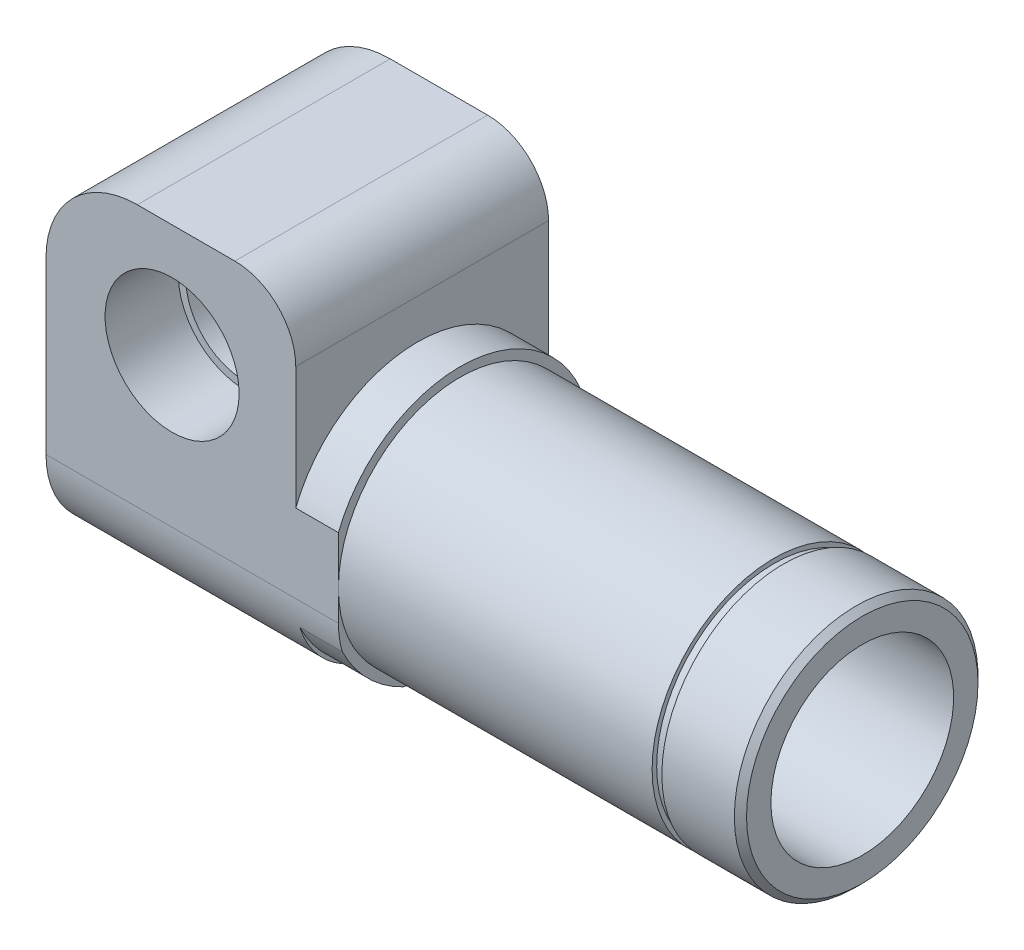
SolidWorks part; units mm, degrees
ref_plane "Face" through (0, 0, 0) normal (0, 0, 1) x (1, 0, 0)
ref_plane "Dessus" through (0, 0, 0) normal (0, 1, 0) x (1, 0, 0)
ref_plane "Droite" through (0, 0, 0) normal (1, 0, 0) x (0, 0, -1)
sketch "Esquisse1" plane through (0, 0, 0) normal (0, 0, 1) x (1, 0, 0)
  line L0 (0, 0) -> (54.7909, 0) construction
  line L1 (0, 5) -> (0, 20)
  line L2 (0, 20) -> (68, 20)
  line L5 (0, 5) -> (3, 5)
  line L6 (3, 5) -> (3, 15)
  line L7 (3, 15) -> (68, 15)
  line L10 (68, 20) -> (68, 15)
  dimension "D1" = 30
  dimension "D2" = 10
  dimension "D3" = 3
  dimension "D4" = 40
  dimension "D5" = 68
revolve "Révolution1" add sketch "Esquisse1" angle 360 about L0
hole_wizard "Fraisage pour vis à tête fraisée M31" positions "Esquisse3" profile "Esquisse2" countersink size "M3" standard "DIN"
sketch "Esquisse3" plane through (0, 0, 0) normal (-1, 0, 0) x (0, 0, 1)
  line L0 (0, 0) -> (7.3612, 4.25) construction
  line L1 (11.1801, -6.4548) -> (-13.0092, 7.5109) construction
  line L2 (0, -16.341) -> (0, 13.6222) construction
  circle A0 centre (0, 0) radius 8.5 construction
  point P0 (7.3612, 4.25)
  point P5 (0, -8.5)
  point P6 (-7.3612, 4.25)
  point P7 (0, -8.5)
  dimension "D1" = 17
  dimension "D2" = 60
  dimension "D3" = 60
sketch "Esquisse2" plane through (0, 4.25, 7.3612) normal (0, 1, 0) x (0, 0, 1)
  line L0 (0, 0) -> (0, 68)
  line L1 (0, 68) -> (1.7, 68)
  line L2 (1.7, 68) -> (1.7, 1.8)
  line L3 (1.7, 1.8) -> (3.5, 0)
  line L5 (3.5, 0) -> (0, 0)
  line L6 (-1.7, 1.8) -> (-3.5, 0) construction
  line L11 (0, -6.35) -> (0, 107.95) construction
  dimension "Diamètre du perçage jusqu'au prochain" = 3.4
  dimension "Profondeur du perçage jusqu'au prochain" = 68
  dimension "Diamètre du fraisage entrant" = 7
  dimension "Angle du fraisage entrant" = 90
sketch "Esquisse4" plane through (0, 0, 0) normal (-1, 0, 0) x (0, 0, 1)
  arc A0 (-10.6027, 2.9298) -> (-2.7641, -10.6471) centre (0, 0) ccw
  circle A2 centre (0, 0) radius 20 construction
  circle A3 centre (0, 0) radius 20
  circle A5 centre (7.3612, 4.25) radius 3.5 construction
  arc A8 (10.6027, 2.9298) -> (7.8386, 7.7173) centre (7.3612, 4.25) ccw
  circle A9 centre (0, -8.5) radius 3.5 construction
  arc A10 (-2.7641, -10.6471) -> (2.7641, -10.6471) centre (0, -8.5) ccw
  circle A11 centre (-7.3612, 4.25) radius 3.5 construction
  arc A12 (-7.8386, 7.7173) -> (-10.6027, 2.9298) centre (-7.3612, 4.25) ccw
  arc A14 (7.8386, 7.7173) -> (-7.8386, 7.7173) centre (0, 0) ccw
  arc A15 (2.7641, -10.6471) -> (10.6027, 2.9298) centre (0, 0) ccw
  dimension "D1" = 22
extrude "Extrusion1" add sketch "Esquisse4" along normal blind 46
sketch "Esquisse5" plane through (-46, 0, 0) normal (-1, 0, 0) x (0, 0, 1)
  line L0 (-21.5, -20) -> (20, -20)
  line L1 (-21.5, -20) -> (-21.5, 38)
  line L2 (20, -20) -> (20, 38)
  line L3 (20, 38) -> (-21.5, 38)
  circle A4 centre (0, 0) radius 20 construction
  circle A5 centre (0, 0) radius 11 construction
  arc A7 (2.7641, -10.6471) -> (10.6027, 2.9298) centre (0, 0) ccw
  arc A9 (-7.8386, 7.7173) -> (-10.6027, 2.9298) centre (-7.3612, 4.25) ccw construction
  arc A10 (-7.8386, 7.7173) -> (-10.6027, 2.9298) centre (-7.3612, 4.25) ccw
  arc A11 (10.6027, 2.9298) -> (7.8386, 7.7173) centre (7.3612, 4.25) ccw construction
  arc A18 (10.6027, 2.9298) -> (7.8386, 7.7173) centre (7.3612, 4.25) ccw
  arc A19 (-2.7641, -10.6471) -> (2.7641, -10.6471) centre (0, -8.5) ccw construction
  arc A20 (-2.7641, -10.6471) -> (2.7641, -10.6471) centre (0, -8.5) ccw
  arc A21 (7.8386, 7.7173) -> (-7.8386, 7.7173) centre (0, 0) ccw
  arc A22 (-10.6027, 2.9298) -> (-2.7641, -10.6471) centre (0, 0) ccw
  dimension "D2" = 21.5
  dimension "D1" = 58
extrude "Extrusion2" add sketch "Esquisse5" against normal blind 42
sketch "Esquisse6" plane through (0, 0, -21.5) normal (0, 0, -1) x (-1, 0, 0)
  circle A0 centre (25.3, 19.5) radius 9.75
  circle A1 centre (25.3, 19.5) radius 4 construction
  dimension "D3" = 19.5
extrude "Enlèv. mat.-Extru.1" cut sketch "Esquisse6" against normal through all
sketch "Esquisse16" plane through (0, 0, -21.5) normal (0, 0, -1) x (-1, 0, 0)
  circle A0 centre (25.3, 19.5) radius 16
  circle A2 centre (25.3, 19.5) radius 9.75 construction
  dimension "D1" = 32
extrude "Enlèv. mat.-Extru.7" cut sketch "Esquisse16" against normal blind 10
sketch "Esquisse17" plane through (-4, 0, 0) normal (1, 0, 0) x (0, 0, -1)
  circle A0 centre (0, 0) radius 21.5
  circle A1 centre (0, 0) radius 15 construction
  circle A2 centre (0, 0) radius 20 construction
  circle A3 centre (0, 0) radius 20
  dimension "D1" = 43
extrude "Extrusion7" add sketch "Esquisse17" along normal blind 6
sketch "Esquisse18" plane through (-46, 0, 0) normal (-1, 0, 0) x (0, 0, 1)
  line L4 (-21.5, 38) -> (-21.5, -20)
  line L5 (-21.5, -20) -> (20, -20)
  line L6 (20, -20) -> (20, 38)
  line L7 (20, 38) -> (-21.5, 38)
  line L8 (-21.5, 38) -> (-21.5, -20)
  line L9 (-21.5, -20) -> (20, -20)
  line L10 (20, -20) -> (20, 38)
  line L11 (20, 38) -> (-21.5, 38)
  dimension "D1" = 0
extrude "Enlèv. mat.-Extru.8" cut sketch "Esquisse18" against normal through all flip side to cut
sketch "Esquisse20" plane through (-4, 0, 0) normal (1, 0, 0) x (0, 0, -1)
  line L0 (22.5, 38) -> (22.5, -25)
  line L1 (21.5, 38) -> (21.5, 0) construction
  line L3 (-20, 38) -> (-20, 7.8899)
  line L4 (21.5, 0) -> (21.5, 38)
  line L5 (21.5, 38) -> (-20, 38)
  line L7 (-25, 38) -> (-25, -25)
  line L8 (22.5, 38) -> (-25, 38)
  line L11 (-25, -25) -> (22.5, -25)
  circle A0 centre (0, 0) radius 21.5
  arc A1 (21.5, 0) -> (-20, 7.8899) centre (0, 0) ccw
  arc A2 (7.8899, -20) -> (-20, 7.8899) centre (0, 0) ccw construction
  dimension "D5" = 1
  dimension "D1" = 25
  dimension "D3" = 25
  dimension "D2" = 0
extrude "Enlèv. mat.-Extru.10" cut sketch "Esquisse20" against normal blind 1
hole_wizard "Trou taraudé M4x0.71" positions "Esquisse22" profile "Esquisse21" tap size "M4x0.7" standard "DIN"
sketch "Esquisse22" plane through (-46, 0, 0) normal (-1, 0, 0) x (0, 0, 1)
  line L0 (0, 0) -> (-10.8275, -6.2513) construction
  line L1 (12.5574, -7.25) -> (0, 0) construction
  line L2 (0, 0) -> (0, 14.5) construction
  circle A0 centre (0, 0) radius 14.5 construction
  point P1 (0, 14.5)
  point P2 (-12.5574, -7.25)
  point P3 (12.5574, -7.25)
  dimension "D1" = 29
  dimension "D2" = 120
  dimension "D3" = 120
sketch "Esquisse21" plane through (-46, 14.5, 0) normal (0, 1, 0) x (0, 0, 1)
  line L0 (0, 0) -> (0, 11.0526)
  line L1 (0, 11.0526) -> (1.65, 10.1)
  line L2 (1.65, 10.1) -> (1.65, 0.35)
  line L3 (1.65, 0.35) -> (2, 0)
  line L5 (2, 0) -> (0, 0)
  line L6 (-1.65, 0.35) -> (-2, 0) construction
  line L10 (0, 11.0526) -> (-1.65, 10.1) construction
  line L11 (0, -6.35) -> (0, 107.95) construction
  dimension "Diamètre du trou pour taraudage" = 3.3
  dimension "Profondeur du trou pour taraudage" = 10.1
  dimension "Diamètre du fraisage entrant" = 4
  dimension "Angle du fraisage entrant" = 90
  dimension "Angle de pointe" = 120
sketch "Esquisse23" plane through (0, 0, 0) normal (-1, 0, 0) x (0, 0, 1)
  arc A3 (10.0509, 2.0104) -> (10.6027, 2.9298) centre (7.3612, 4.25) ccw
  arc A7 (2.7641, -10.6471) -> (3.2844, -9.7096) centre (0, -8.5) ccw
  arc A11 (-6.7665, 7.6991) -> (-7.8386, 7.7173) centre (-7.3612, 4.25) ccw
  arc A13 (2.7641, -10.6471) -> (10.6027, 2.9298) centre (0, 0) ccw
  arc A15 (4.3301, 2.5) -> (10.6027, 2.9298) centre (7.3612, 4.25) ccw construction
  arc A17 (2.7641, -10.6471) -> (0, -5) centre (0, -8.5) ccw construction
  arc A19 (-10.6027, 2.9298) -> (-4.3301, 2.5) centre (-7.3612, 4.25) ccw construction
  arc A21 (2.7641, -10.6471) -> (10.6027, 2.9298) centre (0, 0) ccw construction
  arc A23 (3.2844, -9.7096) -> (10.0509, 2.0104) centre (0, 0) ccw
  arc A25 (-3.2844, -9.7096) -> (-2.7641, -10.6471) centre (0, -8.5) ccw
  arc A26 (6.7665, 7.6991) -> (-6.7665, 7.6991) centre (0, 0) ccw
  arc A27 (7.8386, 7.7173) -> (6.7665, 7.6991) centre (7.3612, 4.25) ccw
  arc A28 (7.8386, 7.7173) -> (-7.8386, 7.7173) centre (0, 0) ccw
  arc A29 (-10.0509, 2.0104) -> (-3.2844, -9.7096) centre (0, 0) ccw
  arc A30 (-10.6027, 2.9298) -> (-2.7641, -10.6471) centre (0, 0) ccw
  arc A31 (-10.6027, 2.9298) -> (-10.0509, 2.0104) centre (-7.3612, 4.25) ccw
  dimension "D1" = 20.5
extrude "Extrusion8" add sketch "Esquisse23" along normal blind 6
sketch "Esquisse25" plane through (0, 0, -11.5) normal (0, 0, -1) x (-1, 0, 0)
  circle A0 centre (25.3, 19.5) radius 14.25
  dimension "D1" = 28.5
extrude "Enlèv. mat.-Extru.11" cut sketch "Esquisse25" against normal blind 15.5
sketch "Esquisse28" plane through (0, 0, 20) normal (0, 0, 1) x (1, 0, 0)
  circle A0 centre (-25.3, 19.5) radius 11
  circle A1 centre (-25.3, 19.5) radius 9.75 construction
  dimension "D1" = 22
extrude "Enlèv. mat.-Extru.13" cut sketch "Esquisse28" against normal blind 12
fillet "Congé5" radius 15 2 edges at (-25.5, -20, -21.5) (-25.5, -20, 20)
fillet "Congé6" radius 15 1 edges at (-46, 38, -0.75)
fillet "Congé7" radius 10 1 edges at (-5, 38, -0.75)
sketch "Esquisse29" plane through (0, -20, 0) normal (0, -1, 0) x (1, 0, 0)
  circle A0 centre (-3.2, 6.5) radius 2
  dimension "D1" = 4
  dimension "D2" = 6.5
  dimension "D3" = 3.2
extrude "Enlèv. mat.-Extru.14" cut sketch "Esquisse29" against normal up to next
sketch "Esquisse30" plane through (0, 0, 0) normal (0, 0, 1) x (1, 0, 0)
  line L0 (68, -20) -> (68, 20) construction
  line L1 (53.5, 20) -> (55.1, 20)
  line L2 (53.5, 20) -> (53.5, 19.25)
  line L3 (53.5, 19.25) -> (55.1, 19.25)
  line L4 (55.1, 20) -> (55.1, 19.25)
  line L5 (0, 0) -> (64.616, 0) construction
  line L6 (68, 20) -> (2, 20) construction
  dimension "D1" = 14.5
  dimension "D2" = 1.6
  dimension "D3" = 38.5
revolve "Enlèvement de matière-Révolution1" cut sketch "Esquisse30" angle 360 about L5
chamfer "Chanfrein1" distance 1 angle 45 1 edges at (68, 0, 20)
